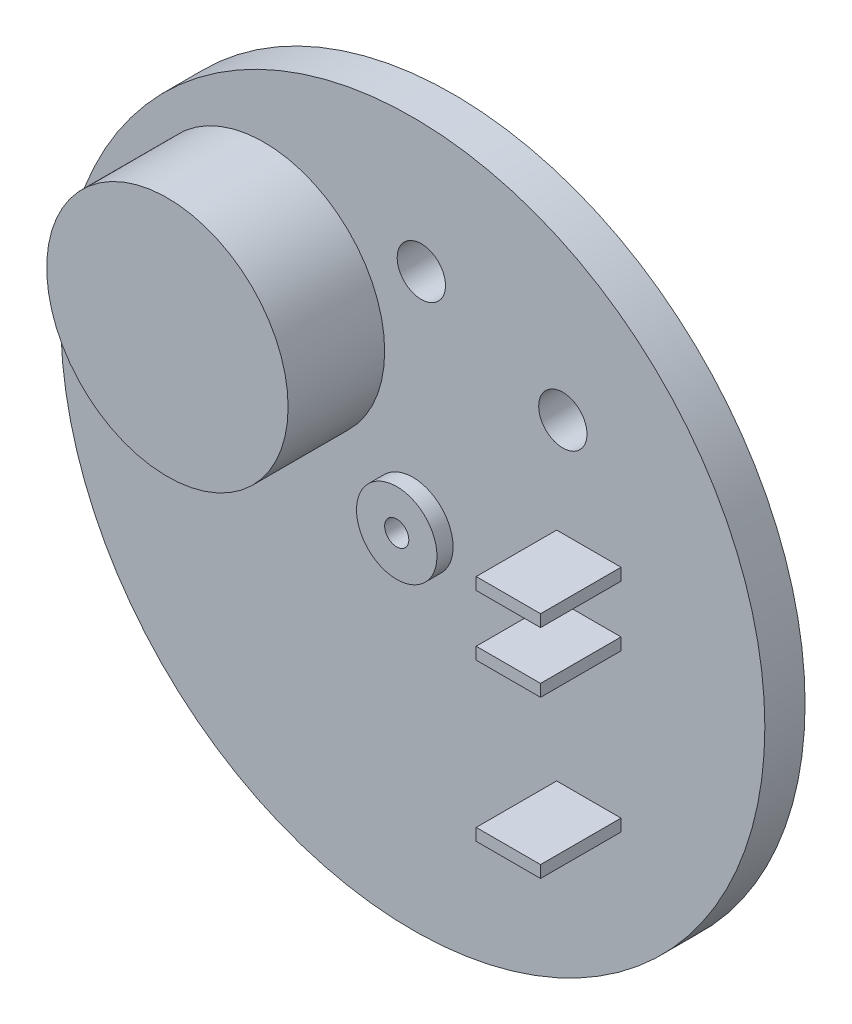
SolidWorks part; units mm, degrees
ref_plane "Plan de face" through (0, 0, 0) normal (0, 0, 1) x (1, 0, 0)
ref_plane "Plan de dessus" through (0, 0, 0) normal (0, 1, 0) x (1, 0, 0)
ref_plane "Plan de droite" through (0, 0, 0) normal (1, 0, 0) x (0, 0, -1)
sketch "Esquisse1" plane through (0, 0, 0) normal (0, 0, 1) x (1, 0, 0)
  circle A0 centre (0, 0) radius 43.75
  circle A1 centre (0, 0) radius 1.5
  dimension "D1" = 87.5
  dimension "D2" = 3
extrude "Boss.-Extru.1" add sketch "Esquisse1" along normal blind 5
sketch "Esquisse2" plane through (0, 0, 5) normal (0, 0, 1) x (1, 0, 0)
  line L0 (-43.75, 0) -> (0, 0) construction
  line L1 (0, 0) -> (0, 43.75) construction
  circle A0 centre (-18.5, 16.8152) radius 15
  circle A4 centre (0, 0) radius 43.75 construction
  dimension "D1" = 30
  dimension "D2" = 25
  dimension "D3" = 18.5
extrude "Boss.-Extru.2" add sketch "Esquisse2" along normal blind 12
sketch "Esquisse3" plane through (0, 0, 5) normal (0, 0, 1) x (1, 0, 0)
  line L0 (0, 0) -> (43.75, 0) construction
  line L2 (17.875, -0.75) -> (25.875, -0.75)
  line L3 (17.875, -0.75) -> (17.875, 0.75)
  line L4 (17.875, 0.75) -> (25.875, 0.75)
  line L5 (25.875, -0.75) -> (25.875, 0.75)
  line L6 (17.875, -0.75) -> (25.875, 0.75) construction
  line L7 (17.875, 0.75) -> (25.875, -0.75) construction
  line L8 (17.875, 6.75) -> (25.875, 6.75)
  line L9 (17.875, 6.75) -> (17.875, 8.25)
  line L10 (17.875, 8.25) -> (25.875, 8.25)
  line L11 (25.875, 6.75) -> (25.875, 8.25)
  line L12 (17.875, 6.75) -> (25.875, 8.25) construction
  line L13 (17.875, 8.25) -> (25.875, 6.75) construction
  line L14 (17.875, -20.25) -> (25.875, -20.25)
  line L15 (17.875, -20.25) -> (17.875, -18.75)
  line L16 (17.875, -18.75) -> (25.875, -18.75)
  line L17 (25.875, -20.25) -> (25.875, -18.75)
  line L18 (17.875, -20.25) -> (25.875, -18.75) construction
  line L19 (17.875, -18.75) -> (25.875, -20.25) construction
  circle A0 centre (0, 0) radius 1.5 construction
  circle A1 centre (0, 0) radius 43.75 construction
  point P5 (21.875, 0)
  point P12 (21.875, 7.5)
  point P19 (21.875, -19.5)
  dimension "D1" = 8
  dimension "D2" = 1.5
  dimension "D3" = 6
  dimension "D4" = 1.5
  dimension "D5" = 8
  dimension "D6" = 25.875
  dimension "D7" = 1.5
  dimension "D8" = 8
  dimension "D9" = 18
  dimension "D10" = 25.875
extrude "Boss.-Extru.3" add sketch "Esquisse3" along normal blind 10
sketch "Esquisse5" plane through (0, 0, 5) normal (0, 0, 1) x (1, 0, 0)
  circle A0 centre (0, 0) radius 5
  circle A1 centre (0, 0) radius 1.5
  circle A2 centre (-18.5, 16.8152) radius 15 construction
  circle A3 centre (0, 0) radius 43.75 construction
  dimension "D1" = 10
  dimension "D2" = 3
  dimension "D3" = 18.5
  dimension "D4" = 38.75
extrude "Boss.-Extru.5" add sketch "Esquisse5" along normal blind 2
sketch "Esquisse7" plane through (0, 0, 0) normal (0, 0, -1) x (-1, 0, 0)
  line L0 (0, 0) -> (-1.0562, 27.6611) construction
  line L1 (0, 0) -> (-18.6404, 20.4642) construction
  circle A0 centre (-1.0562, 27.6611) radius 3
  circle A1 centre (-18.6404, 20.4642) radius 3
  dimension "D1" = 27.6611
  dimension "D3" = 6
  dimension "D4" = 6
  dimension "D2" = 27.6812
  dimension "D5" = 19
extrude "Enlèv. mat.-Extru.1" cut sketch "Esquisse7" against normal blind 10
